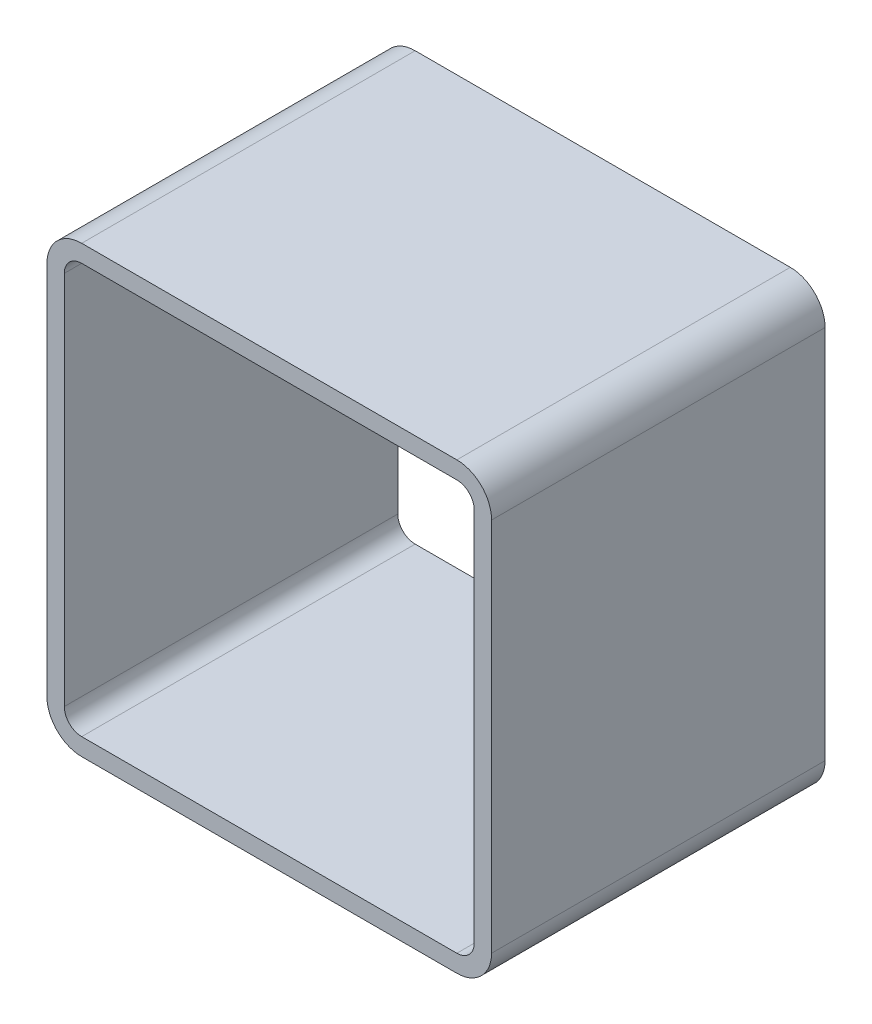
SolidWorks part; units mm, degrees
ref_plane "Front Plane" through (0, 0, 0) normal (0, 0, 1) x (1, 0, 0)
ref_plane "Top Plane" through (0, 0, 0) normal (0, 1, 0) x (1, 0, 0)
ref_plane "Right Plane" through (0, 0, 0) normal (1, 0, 0) x (0, 0, -1)
sketch "Sketch1" plane through (0, 0, 0) normal (0, 0, 1) x (1, 0, 0)
  point P0 (0, 0)
sketch_block_instance "HSS16x16x0.625-1"
sketch_block "HSS16x16x0.625"
extrude "Boss-Extrude1" add sketch "Sketch1" along normal blind 304.8
